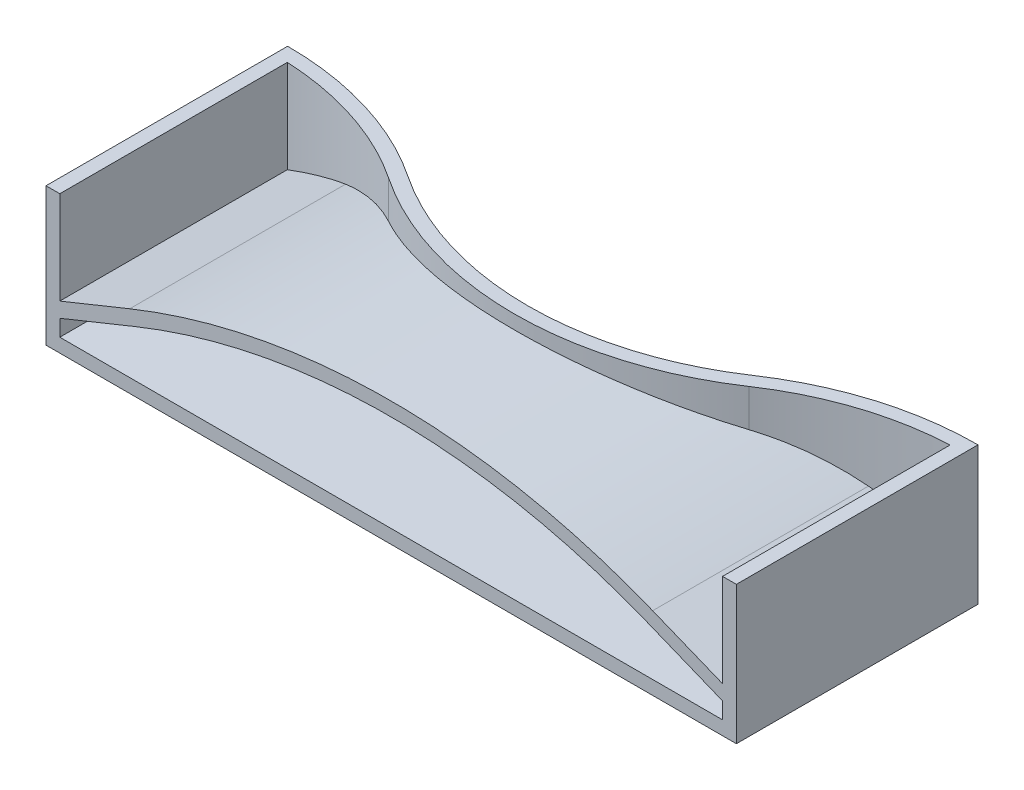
SolidWorks part; units mm, degrees
ref_plane "Front Plane" through (0, 0, 0) normal (0, 0, 1) x (1, 0, 0)
ref_plane "Top Plane" through (0, 0, 0) normal (0, 1, 0) x (1, 0, 0)
ref_plane "Right Plane" through (0, 0, 0) normal (1, 0, 0) x (0, 0, -1)
sketch "Sketch2" plane through (0, 0, 0) normal (0, 1, 0) x (1, 0, 0)
  line L0 (0, 0) -> (0, 35)
  line L1 (100, 35) -> (100, 0)
  line L2 (100, 0) -> (0, 0)
  arc A0 (0, 35) -> (25, 27.4166) centre (0, -10) cw
  arc A1 (25, 27.4166) -> (75, 27.4166) centre (50, 64.8331) ccw
  arc A2 (75, 27.4166) -> (100, 35) centre (100, -10) cw
  dimension "D1" = 45
  dimension "D2" = 100
  dimension "D3" = 35
extrude "Extrude1" add sketch "Sketch2" along normal blind 20
shell "Shell1" thickness 2
sketch "Sketch4" plane through (0, 0, 0) normal (0, 0, 1) x (1, 0, 0)
  line L0 (50, 2) -> (50, 17) construction
  line L1 (2, 2) -> (98, 2) construction
  arc A0 (12.5, 9.7025) -> (87.5, 9.7025) centre (50, -83) cw
  dimension "D2" = 100
  dimension "D1" = 75
  dimension "D3" = 15
rib "Rib1" sketch "Sketch4" sketch "Sketch4" thickness 2 extrusion direction normal to sketch draft on no parameters "D1"=2
